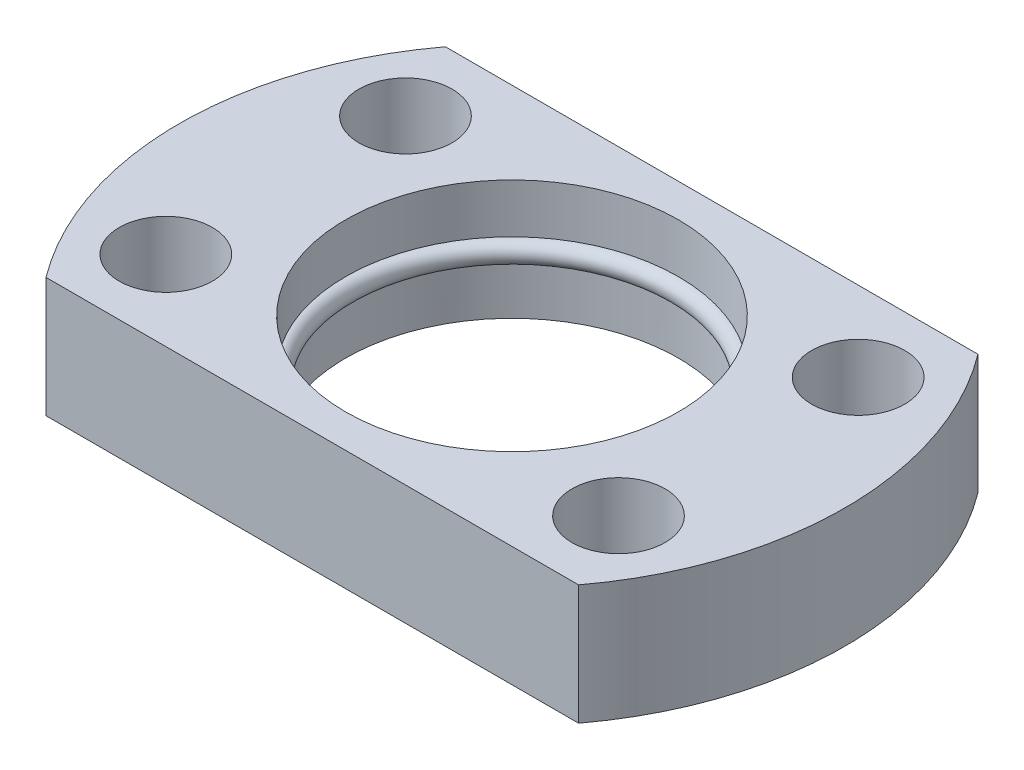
SolidWorks part; units mm, degrees
ref_plane "Front Plane" through (0, 0, 0) normal (0, 0, 1) x (1, 0, 0)
ref_plane "Top Plane" through (0, 0, 0) normal (0, 1, 0) x (1, 0, 0)
ref_plane "Right Plane" through (0, 0, 0) normal (1, 0, 0) x (0, 0, -1)
sketch "Sketch1" plane through (0, 0, 0) normal (0, 1, 0) x (1, 0, 0)
  line L1 (-20, 15) -> (20, 15)
  line L3 (-20, -15) -> (20, -15)
  line L4 (-17, -9) -> (17, -9) construction
  line L5 (-17, -9) -> (-17, 9) construction
  line L6 (-17, 9) -> (17, 9) construction
  line L7 (17, -9) -> (17, 9) construction
  line L8 (-17, -9) -> (17, 9) construction
  line L9 (-17, 9) -> (17, -9) construction
  circle A0 centre (0, 0) radius 12.5
  arc A1 (-20, 15) -> (-20, -15) centre (0, 0) ccw
  arc A2 (20, -15) -> (20, 15) centre (0, 0) ccw
  circle A3 centre (-17, 9) radius 3.5
  circle A4 centre (-17, -9) radius 3.5
  circle A5 centre (17, -9) radius 3.5
  circle A6 centre (17, 9) radius 3.5
  dimension "D1" = 25
  dimension "D2" = 50
  dimension "D6" = 7
  dimension "D3" = 30
  dimension "D4" = 18
  dimension "D5" = 34
extrude "Boss-Extrude1" add sketch "Sketch1" along normal mid plane 9
sketch "Sketch2" plane through (0, 0, 0) normal (0, 0, 1) x (1, 0, 0)
  line L0 (-12.5, 0) -> (0, 0) construction
  line L1 (0, 0) -> (0, 4.5) construction
  line L2 (-20, 4.5) -> (20, 4.5) construction
  circle A0 centre (-12.5, 0) radius 0.8
  dimension "D1" = 1.6
  dimension "D2" = 25
revolve "Revolve1" add sketch "Sketch2" angle 360 about L1
